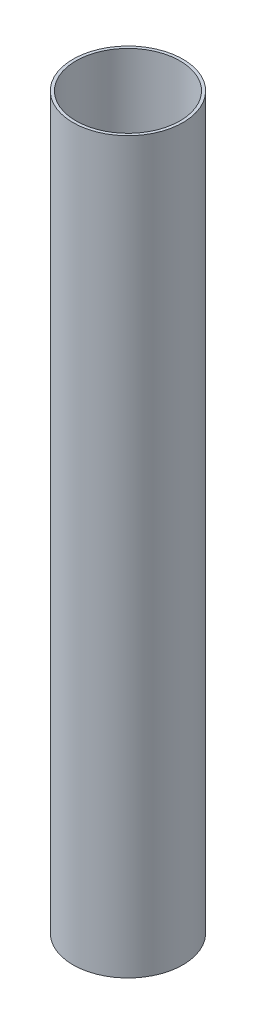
SolidWorks part; units mm, degrees
ref_plane "Front Plane" through (0, 0, 0) normal (0, 0, 1) x (1, 0, 0)
ref_plane "Top Plane" through (0, 0, 0) normal (0, 1, 0) x (1, 0, 0)
ref_plane "Right Plane" through (0, 0, 0) normal (1, 0, 0) x (0, 0, -1)
sketch "Sketch1" plane through (0, 0, 0) normal (0, 1, 0) x (1, 0, 0)
  circle A0 centre (0, 0) radius 28.702
  dimension "D1" = 57.404
extrude "Extrude-Thin1" add sketch "Sketch1" along normal blind 381 thin
